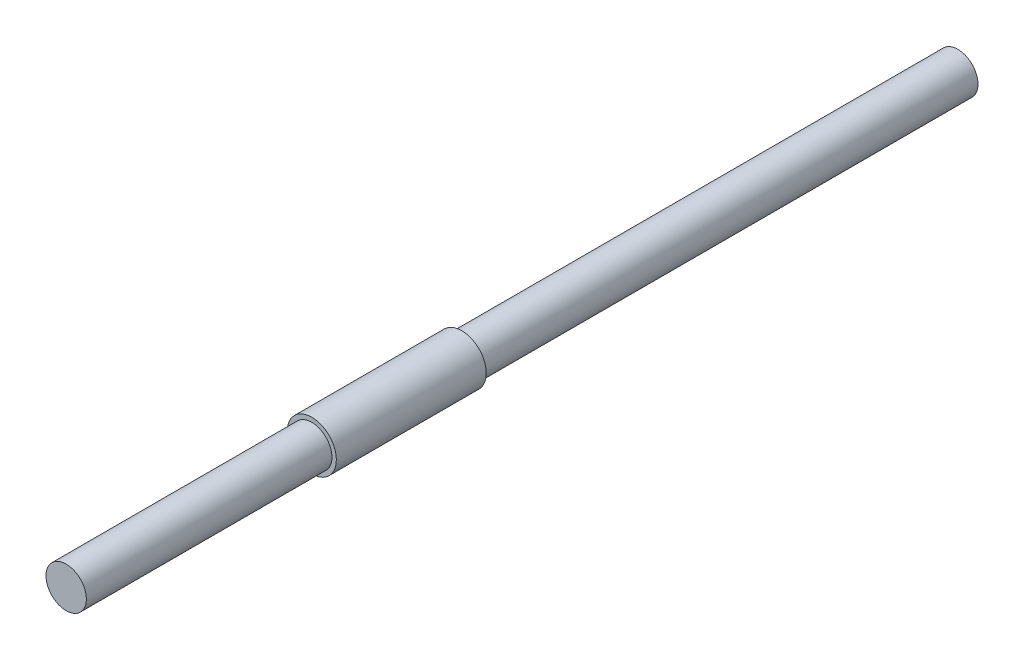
SolidWorks part; units mm, degrees
ref_plane "Front" through (0, 0, 0) normal (0, 0, 1) x (1, 0, 0)
ref_plane "Top" through (0, 0, 0) normal (0, 1, 0) x (1, 0, 0)
ref_plane "Right" through (0, 0, 0) normal (1, 0, 0) x (0, 0, -1)
sketch "Sketch1" plane through (0, 0, 0) normal (0, 0, 1) x (1, 0, 0)
  circle A0 centre (44.45, 95.25) radius 1.3
extrude "Boss-Extrude1" add sketch "Sketch1" along normal blind 33.274 and the other way blind 24.13
sketch "Sketch2" plane through (0, 0, 17.4625) normal (0, 0, 1) x (1, 0, 0)
  circle A0 centre (44.45, 95.25) radius 1.5821
extrude "Boss-Extrude2" add sketch "Sketch2" against normal blind 9.652
